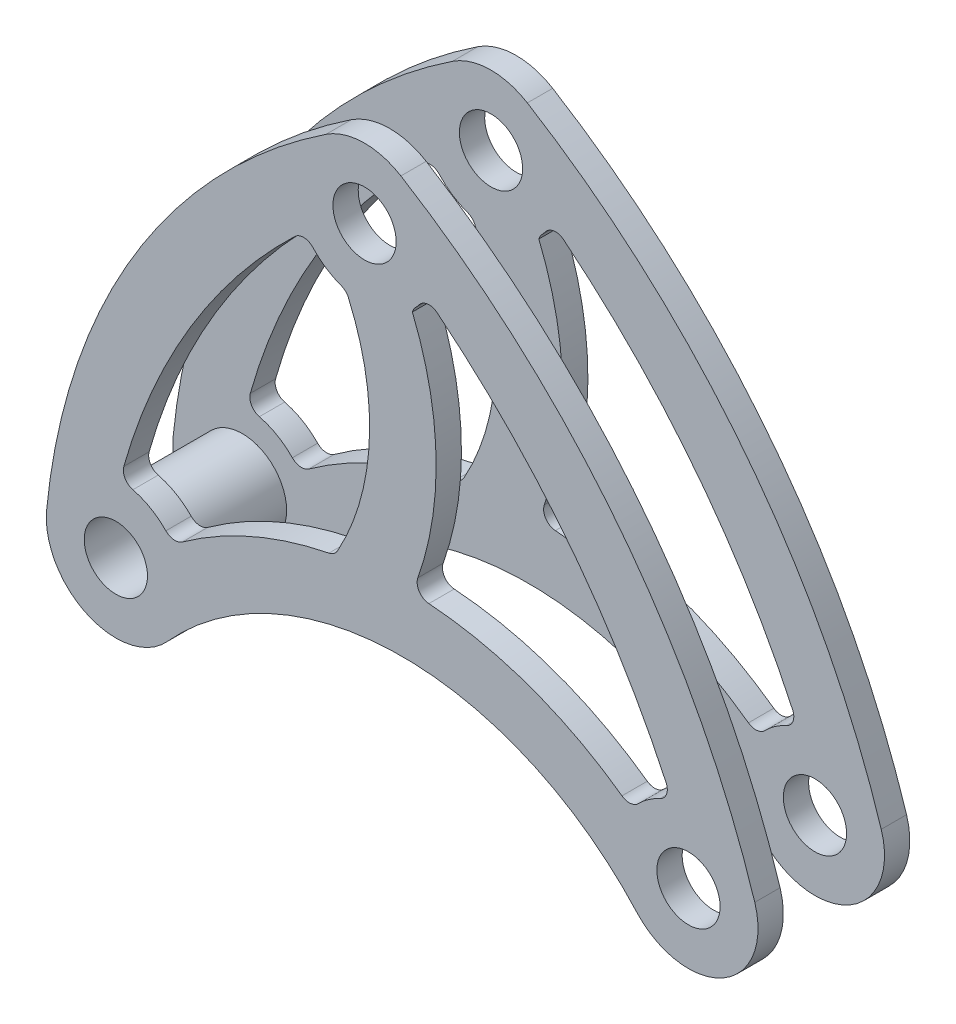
SolidWorks part; units mm, degrees
ref_plane "Front Plane" through (0, 0, 0) normal (0, 0, 1) x (1, 0, 0)
ref_plane "Top Plane" through (0, 0, 0) normal (0, 1, 0) x (1, 0, 0)
ref_plane "Right Plane" through (0, 0, 0) normal (1, 0, 0) x (0, 0, -1)
sketch "Sketch1" plane through (0, 0, 0) normal (0, 0, 1) x (1, 0, 0)
  line L5 (33.6577, 56.0159) -> (5.6654, 9.4288) construction
  line L7 (16.4857, 0) -> (74.0643, 0) construction
  line L8 (83.7699, 8.662) -> (47.2407, 55.3297) construction
  circle A20 centre (0, 0) radius 5
  arc A21 (-10.9475, 1.0734) -> (8.1643, -7.3718) centre (0, 0) ccw
  circle A22 centre (39.3232, 65.4447) radius 5
  arc A23 (45.0722, 74.8228) -> (33.2358, 74.6068) centre (39.3232, 65.4447) ccw
  circle A24 centre (90.55, 0) radius 5
  arc A25 (86.0253, 10.0263) -> (82.6406, 7.6447) centre (90.55, 0) ccw
  arc A26 (8.1643, -7.3718) -> (82.3857, -7.3718) centre (45.275, -40.88) cw
  arc A29 (36.776, 54.0062) -> (35.6174, 55.0877) centre (34.9436, 53.2046) ccw
  arc A31 (33.2358, 74.6068) -> (-10.9475, 1.0734) centre (88.5752, -8.6851) ccw
  arc A32 (28.307, 58.1586) -> (31.1726, 58.0577) centre (29.6907, 56.7145) cw
  arc A33 (2.696, 10.6645) -> (1.2615, 13.1473) centre (3.1861, 12.6035) cw
  arc A34 (45.0722, 74.8228) -> (101.0343, 3.3286) centre (-22.8711, -36.0091) cw
  arc A35 (36.776, 54.0062) -> (35.0495, 18.4682) centre (0.1287, 37.9756) cw
  arc A36 (46.7814, 57.3593) -> (47.7573, 21.1315) centre (0.1287, 37.9756) cw
  arc A37 (50.797, 58.9649) -> (87.0154, 12.6942) centre (-30.8139, -42.2263) cw
  arc A38 (10.5159, 7.4114) -> (7.9094, 7.6447) centre (9.3475, 9.0346) cw
  arc A39 (47.3552, 57.929) -> (47.9694, 58.6445) centre (39.3232, 65.4447) ccw
  arc A40 (31.1726, 58.0577) -> (35.6174, 55.0877) centre (39.3232, 65.4447) ccw
  arc A41 (1.2615, 13.1473) -> (28.307, 58.1586) centre (97.4937, -14.0439) cw
  arc A42 (10.5159, 7.4114) -> (33.6928, 17.4818) centre (45.275, -40.88) cw
  arc A43 (7.9094, 7.6447) -> (2.696, 10.6645) centre (0, 0) ccw
  arc A44 (49.5008, 18.4697) -> (80.0341, 7.4114) centre (45.275, -40.88) cw
  arc A45 (35.0495, 18.4682) -> (33.6928, 17.4818) centre (33.3035, 19.4436) cw
  arc A46 (47.7573, 21.1315) -> (49.5008, 18.4697) centre (49.6429, 20.4647) ccw
  arc A47 (82.3857, -7.3718) -> (101.0343, 3.3286) centre (90.55, 0) ccw
  arc A48 (80.0341, 7.4114) -> (82.6406, 7.6447) centre (81.2025, 9.0346) ccw
  arc A49 (86.0253, 10.0263) -> (87.0154, 12.6942) centre (85.2026, 11.8493) ccw
  arc A50 (47.2407, 55.3297) -> (47.3552, 57.929) centre (48.8156, 56.5625) cw
  arc A51 (47.9694, 58.6445) -> (50.797, 58.9649) centre (49.5415, 57.4082) cw
  point P15 (29.946, 59.6942)
  point P27 (9.0188, 6.2977)
  point P31 (0, 0)
  point P36 (0, 0)
  point P37 (0, 37.7307)
  point P57 (46.1033, 56.7828)
  dimension "D4" = 22
  dimension "D5" = 10
  dimension "D6" = 22
  dimension "D7" = 50
  dimension "D8" = 2
  dimension "D15" = 130
  dimension "D1" = 10
  dimension "D2" = 22
  dimension "D3" = 10
  dimension "D10" = 40
  dimension "D12" = 100
extrude "Boss-Extrude1" add sketch "Sketch1" along normal blind 24
sketch "Sketch2" plane through (0, 0, 0) normal (1, 0, 0) x (0, 0, -1)
  line L0 (0, 76.4447) -> (-24, 76.4447) construction
  line L1 (-20, 76.4447) -> (-4, 76.4447)
  line L2 (-20, 76.4447) -> (-20, -11)
  line L3 (-20, -11) -> (-4, -11)
  line L4 (-4, 76.4447) -> (-4, -11)
  line L5 (-24, -11) -> (0, -11) construction
  dimension "D1" = 4
  dimension "D2" = 16
extrude "Cut-Extrude1" cut sketch "Sketch2" against normal through all both and the other way through all
sketch "Sketch3" plane through (0, 0, 4) normal (0, 0, 1) x (1, 0, 0)
  circle A0 centre (0, 0) radius 5
  circle A1 centre (0, 0) radius 7
  dimension "D1" = 14
  dimension "D2" = 10
extrude "Boss-Extrude2" add sketch "Sketch3" along normal blind 18
